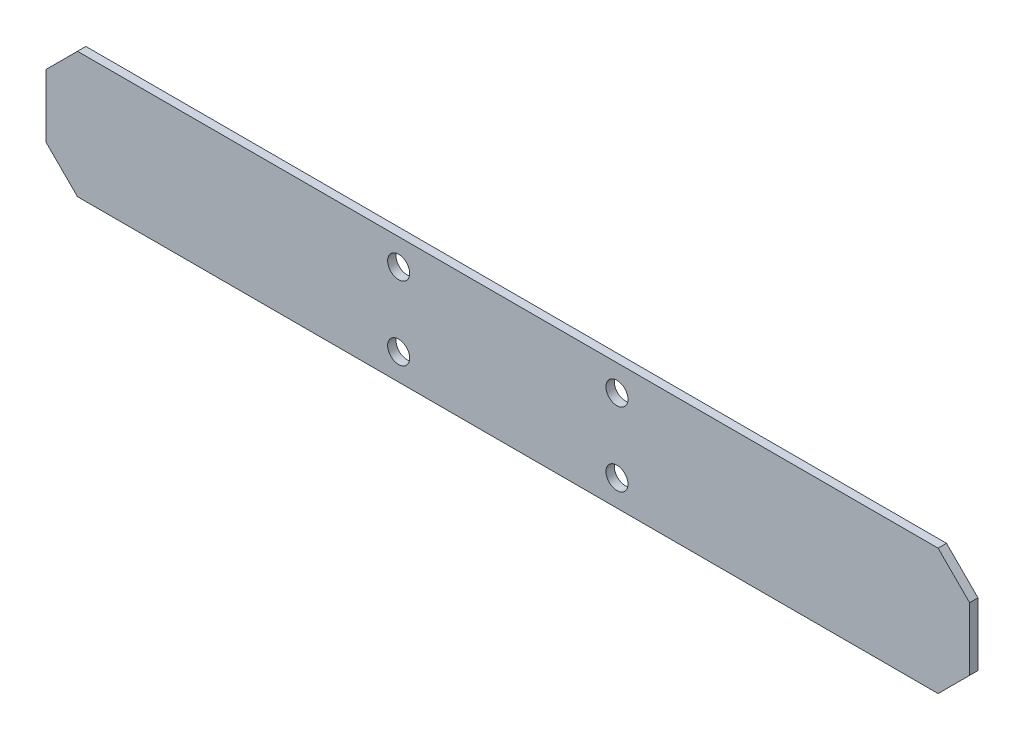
SolidWorks part; units mm, degrees
ref_plane "前视基准面" through (0, 0, 0) normal (0, 0, 1) x (1, 0, 0)
ref_plane "上视基准面" through (0, 0, 0) normal (0, 1, 0) x (1, 0, 0)
ref_plane "右视基准面" through (0, 0, 0) normal (1, 0, 0) x (0, 0, -1)
sketch "草图1" plane through (0, 0, 0) normal (0, 0, 1) x (1, 0, 0)
  line L0 (-127.9632, 0) -> (144.0344, 0) construction
  line L1 (0, 65.4978) -> (0, -56.0976) construction
  line L3 (-440, 60) -> (440, 60)
  line L4 (-440, 60) -> (-440, -60)
  line L5 (-440, -60) -> (440, -60)
  line L6 (440, 60) -> (440, -60)
  circle A0 centre (-104, 35) radius 10.5
  circle A1 centre (-104, -35) radius 10.5
  circle A2 centre (104, -35) radius 10.5
  circle A3 centre (104, 35) radius 10.5
  dimension "D3" = 21
  dimension "D4" = 104
  dimension "D5" = 35
  dimension "D1" = 120
  dimension "D2" = 880
extrude "拉伸1" add sketch "草图1" along normal blind 8
chamfer "倒角1" distance 30 angle 45 4 edges at (440, -60, 4) (440, 60, 4) (-440, -60, 4) (-440, 60, 4)
